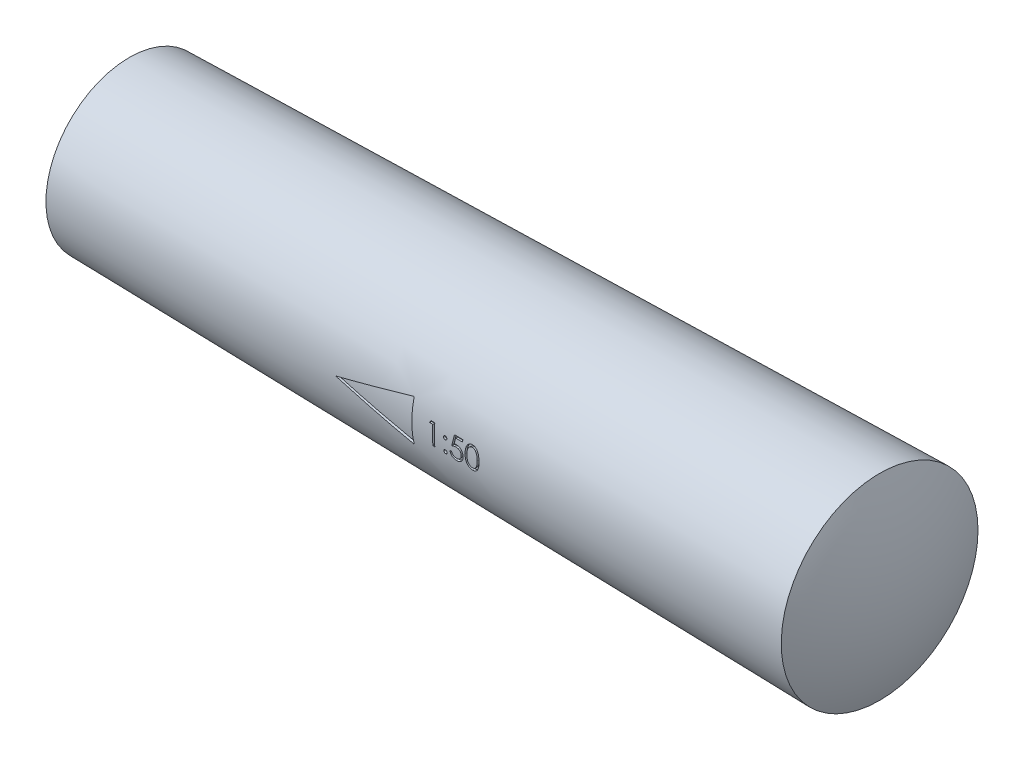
SolidWorks part; units mm, degrees
ref_plane "Front Plane" through (0, 0, 0) normal (0, 0, 1) x (1, 0, 0)
ref_plane "Top Plane" through (0, 0, 0) normal (0, 1, 0) x (1, 0, 0)
ref_plane "Right Plane" through (0, 0, 0) normal (1, 0, 0) x (0, 0, -1)
sketch "Sketch1" plane through (0, 0, 0) normal (1, 0, 0) x (0, 0, -1)
  circle A0 centre (0, 0) radius 4
  dimension "D1" = 8
extrude "Extrude1" add sketch "Sketch1" along normal mid plane 36
draft "Draft1" type of draft neutral plane draft angle 1.146 faces to draft 1 parameters "D1"=1.146
sketch "Sketch2" plane through (0, 0, 0) normal (0, 0, 1) x (1, 0, 0)
  line L0 (-18, 0) -> (-18, 4)
  line L1 (-18, 4) -> (-18, -4) construction
  line L2 (-18, 0) -> (-19, 0)
  line L3 (-19, 0) -> (-19, -4.36) construction
  line L4 (18, 0) -> (18, 4.72)
  line L5 (18, -4.72) -> (18, 4.72) construction
  line L6 (18, 0) -> (19, 0)
  line L7 (19, 0) -> (19, -4.36) construction
  line L8 (-18, -4) -> (18, -4.72) construction
  arc A0 (-19, 0) -> (-18, 4) centre (-10.5, 0) cw
  arc A1 (19, 0) -> (18, 4.72) centre (7.3607, 0) ccw
  point P14 (0, -4.36)
revolve "Revolve1" add sketch "Sketch2" angle 360 about L2
sketch "Sketch5" plane through (0, 0, 0) normal (0, 0, 1) x (1, 0, 0)
  line L0 (0, 4.36) -> (0, -4.36) construction
  line L1 (18, 4.72) -> (-18, 4) construction
  line L2 (-18, -4) -> (18, -4.72) construction
ref_plane "Plane2" through (0, 0, 0) normal (-0.02, 0, 0.9998) x (0.9998, 0, 0.02)
sketch "Sketch6" plane through (0, 0, 0) normal (-0.02, 0, 0.9998) x (0.9998, 0, 0.02)
  line L0 (0, 0) -> (0, 1)
  line L1 (0, 4.36) -> (0, -4.36) construction
  line L2 (0, 1) -> (-3.7321, 0)
  line L3 (-3.7321, 0) -> (0, -1)
  line L4 (0, -1) -> (0, 0)
  line L5 (0, -0.5) -> (4, -0.5) construction
  text T0 "1:50" font "Century Gothic" height 1
  dimension "D1" = 2
  dimension "D2" = 30
  dimension "D3" = 4
wrap "Wrap2" sketch "Sketch6" wrap type deboss source sketch "Sketch6" thickness 0.1 parameters "D1"=0.1
equation "\"D2@Sketch2\" = \"D1@Sketch2\""
